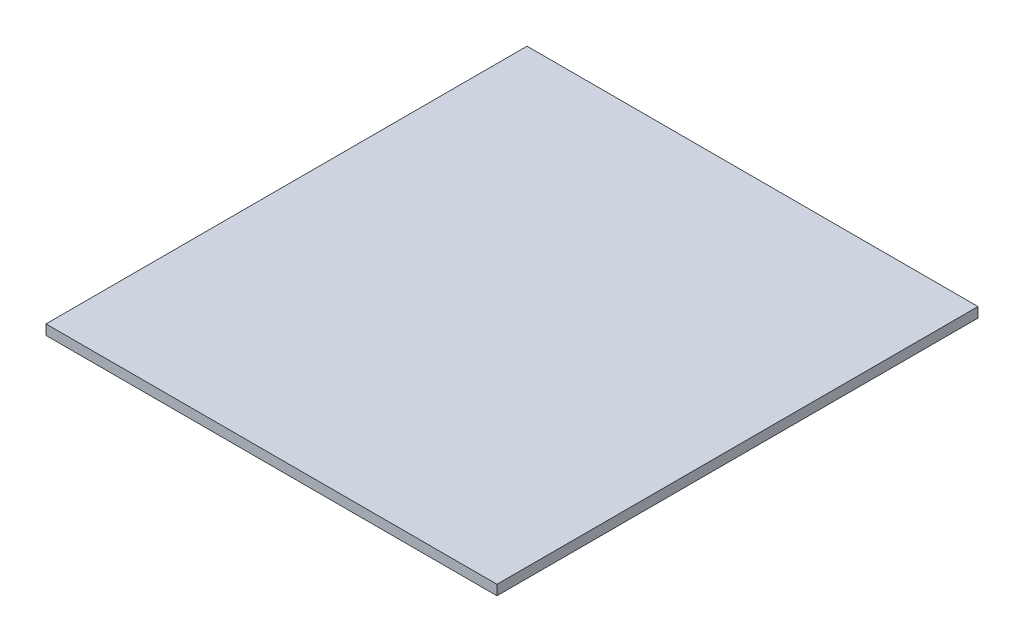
SolidWorks part; units mm, degrees
ref_plane "Front" through (0, 0, 0) normal (0, 0, 1) x (1, 0, 0)
ref_plane "Top" through (0, 0, 0) normal (0, 1, 0) x (1, 0, 0)
ref_plane "Right" through (0, 0, 0) normal (1, 0, 0) x (0, 0, -1)
sketch "Sketch1" plane through (0, 0, 0) normal (0, 1, 0) x (1, 0, 0)
  line L1 (-571.5, -609.6) -> (571.5, -609.6)
  line L2 (-571.5, -609.6) -> (-571.5, 609.6)
  line L3 (-571.5, 609.6) -> (571.5, 609.6)
  line L4 (571.5, -609.6) -> (571.5, 609.6)
  line L5 (-571.5, -609.6) -> (571.5, 609.6) construction
  line L6 (-571.5, 609.6) -> (571.5, -609.6) construction
  point P0 (0, 0)
  dimension "D1" = 1143
  dimension "D2" = 1219.2
extrude "Boss-Extrude1" add sketch "Sketch1" along normal blind 25.4
